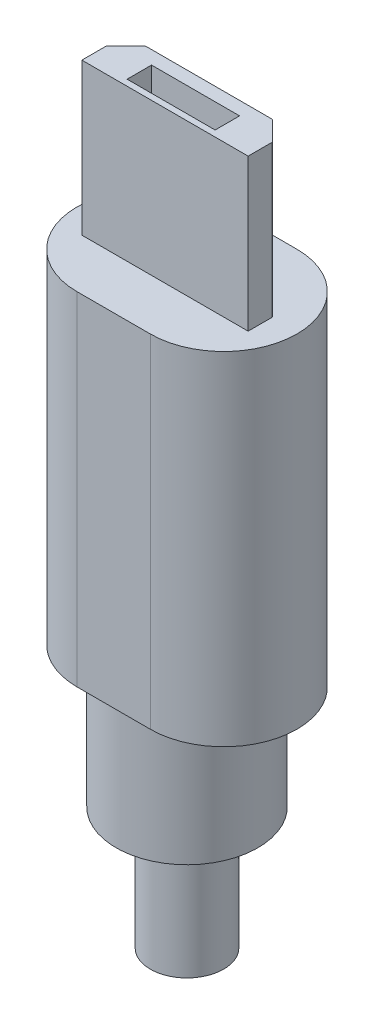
SolidWorks part; units mm, degrees
ref_plane "前视基准面" through (0, 0, 0) normal (0, 0, 1) x (1, 0, 0)
ref_plane "上视基准面" through (0, 0, 0) normal (0, 1, 0) x (1, 0, 0)
ref_plane "右视基准面" through (0, 0, 0) normal (1, 0, 0) x (0, 0, -1)
other "Configuration Table"
sketch "草图1" plane through (0, 0, 0) normal (0, 1, 0) x (1, 0, 0)
  line L0 (-1.5, 0) -> (1.5, 0) construction
  line L1 (-1.5, 3) -> (1.5, 3)
  line L2 (-1.5, -3) -> (1.5, -3)
  arc A0 (-1.5, 3) -> (-1.5, -3) centre (-1.5, 0) ccw
  arc A1 (1.5, -3) -> (1.5, 3) centre (1.5, 0) ccw
  point P3 (0, 0)
  point P9 (-4.5, 0)
  point P10 (4.5, 0)
  dimension "D1" = 3
  dimension "D2" = 9
extrude "凸台-拉伸1" add sketch "草图1" along normal blind 14
sketch "草图2" plane through (0, 0, 0) normal (0, -1, 0) x (1, 0, 0)
  circle A0 centre (0, 0) radius 2.9
  dimension "D1" = 5.8
extrude "凸台-拉伸2" add sketch "草图2" along normal blind 5
sketch "草图3" plane through (0, 14, 0) normal (0, 1, 0) x (1, 0, 0)
  line L0 (-3.4, 0.1) -> (-2.6, 0.9)
  line L1 (-3.4, 0.9) -> (3.4, 0.9) construction
  line L2 (-3.4, 0.9) -> (-3.4, -0.9) construction
  line L3 (-3.4, -0.9) -> (3.4, -0.9)
  line L4 (3.4, 0.9) -> (3.4, -0.9) construction
  line L5 (-3.4, 0.9) -> (3.4, -0.9) construction
  line L6 (-3.4, -0.9) -> (3.4, 0.9) construction
  line L7 (2.6, 0.9) -> (3.4, 0.1)
  line L8 (0, 0.9) -> (0, -0.9) construction
  line L9 (-2.6, 0.9) -> (2.6, 0.9)
  line L10 (-3.4, 0.1) -> (-3.4, -0.9)
  line L11 (3.4, 0.1) -> (3.4, -0.9)
  point P0 (0, 0)
  dimension "D1" = 6.8
  dimension "D2" = 1.8
  dimension "D3" = 0.8
  dimension "D4" = 0.8
  dimension "D5" = 0.8
  dimension "D6" = 0.8
extrude "凸台-拉伸3" add sketch "草图3" along normal blind 6.2
sketch "草图5" plane through (0, 20.2, 0) normal (0, 1, 0) x (1, 0, 0)
  line L0 (-3.4, -0.9) -> (3.4, -0.9) construction
  line L1 (1.8, -0.65) -> (-1.8, -0.65)
  line L2 (1.8, -0.65) -> (1.8, 0.35)
  line L3 (1.8, 0.35) -> (-1.8, 0.35)
  line L4 (-1.8, -0.65) -> (-1.8, 0.35)
  line L5 (1.8, -0.65) -> (-1.8, 0.35) construction
  line L6 (1.8, 0.35) -> (-1.8, -0.65) construction
  line L7 (0, 0.9) -> (0, -0.9) construction
  line L8 (2.6, 0.9) -> (-2.6, 0.9) construction
  point P0 (0, -0.15)
  dimension "D1" = 0.25
  dimension "D2" = 1
  dimension "D3" = 3.6
extrude "切除-拉伸1" cut sketch "草图5" against normal blind 4
fillet "圆角1" radius 0.1 4 edges at (3.4, 17.1, -0.1) (2.6, 17.1, -0.9) (-3.4, 17.1, -0.1) (-2.6, 17.1, -0.9)
sketch "草图6" plane through (0, -5, 0) normal (0, -1, 0) x (1, 0, 0)
  circle A0 centre (0, 0) radius 1.5
  dimension "D1" = 3
extrude "凸台-拉伸4" add sketch "草图6" along normal blind 5
sketch "草图8" plane through (0, 0, -3) normal (0, 0, -1) x (-1, 0, 0)
  line L0 (0, 11.5456) -> (0, 1.9082) construction
  line L1 (0, 11.5296) -> (-0.717, 10.8097)
  line L2 (0.635, 9.4075) -> (1.524, 9.4075)
  line L3 (0.635, 9.4075) -> (0.635, 8.5185)
  line L4 (0.635, 8.963) -> (1.524, 8.963) construction
  line L5 (0.635, 8.5185) -> (0.9547, 8.5185)
  line L6 (1.524, 9.4075) -> (1.524, 8.5185)
  line L7 (-0.127, 3.5695) -> (-0.127, 4.8449)
  line L8 (0.127, 3.5695) -> (0.127, 5.9335)
  line L9 (-0.717, 10.8097) -> (-0.127, 10.8097)
  line L10 (0.717, 10.8097) -> (0, 11.5296)
  line L11 (0, 11.5296) -> (0, 11.6076) construction
  line L12 (0.9547, 8.5185) -> (1.2043, 8.5185) construction
  line L13 (0.2185, 6.5586) -> (0.8034, 7.3428)
  line L14 (1.2043, 8.5185) -> (1.2043, 7.715)
  line L15 (1.0531, 7.2594) -> (0.1774, 6.0854)
  line L16 (-0.2102, 5.3627) -> (-1.1205, 6.1153)
  line L17 (-1.397, 6.7026) -> (-1.397, 7.9631)
  line L18 (-1.651, 12.2591) -> (-1.397, 12.2591) construction
  line L19 (-0.2192, 5.0406) -> (-1.267, 5.9069)
  line L20 (-1.651, 6.7225) -> (-1.651, 7.9631)
  line L21 (-1.524, 12.2591) -> (-1.524, 7.9619) construction
  line L22 (0.9547, 8.5185) -> (0.9547, 7.7984)
  line L23 (0.127, 6.7225) -> (-0.127, 6.7225) construction
  line L24 (0, 6.7225) -> (0, 7.1521) construction
  line L25 (0.127, 10.8097) -> (0.717, 10.8097)
  line L26 (1.2043, 8.5185) -> (1.524, 8.5185)
  line L27 (-0.127, 5.4019) -> (-0.127, 10.8097)
  line L28 (0.127, 6.589) -> (0.127, 10.8097)
  line L29 (0, 11.9082) -> (0, 11.5296) construction
  line L34 (0, 0) -> (0, 14) construction
  line L35 (-1.5, 14) -> (1.5, 14) construction
  arc A0 (-0.127, 3.5695) -> (0.127, 3.5695) centre (0, 2.9474) ccw
  arc A1 (-1.397, 7.9631) -> (-1.651, 7.9631) centre (-1.524, 8.455) ccw
  arc A2 (1.2043, 7.715) -> (1.0531, 7.2594) centre (0.4423, 7.715) cw
  arc A3 (0.9547, 7.7984) -> (0.8034, 7.3428) centre (0.1927, 7.7984) cw
  arc A4 (-1.397, 6.7026) -> (-1.1205, 6.1153) centre (-0.635, 6.7026) ccw
  arc A5 (-1.651, 6.7225) -> (-1.267, 5.9069) centre (-0.5927, 6.7225) ccw
  arc A6 (-0.127, 5.4019) -> (-0.2102, 5.3627) centre (-0.1778, 5.4019) cw
  arc A7 (0.127, 6.589) -> (0.2185, 6.5586) centre (0.1778, 6.589) ccw
  arc A8 (0.1774, 6.0854) -> (0.127, 5.9335) centre (0.381, 5.9335) ccw
  arc A9 (-0.127, 4.8449) -> (-0.2192, 5.0406) centre (-0.381, 4.8449) ccw
  dimension "D1" = 1.27
  dimension "D2" = 1.016
  dimension "D9" = 0.762
  dimension "D12" = 0.762
  dimension "D14" = 0.0508
  dimension "D15" = 0.254
  dimension "D25" = 1.0583
  dimension "D3" = 0.889
  dimension "D4" = 1.016
  dimension "D5" = 0.508
  dimension "D6" = 1.397
  dimension "D7" = 0.508
  dimension "D8" = 0.254
  dimension "D10" = 0.254
  dimension "D11" = 50.42
  dimension "D13" = 0.254
  dimension "D19" = 0.2497
  dimension "D21" = 0.3786
  dimension "D22" = 5.5076
  dimension "D23" = 1.8975
  dimension "D24" = 7.8624
  dimension "D26" = 2.9862
  dimension "D27" = 3.6416
  dimension "D28" = 0.25
  dimension "D29" = 1.126
extrude "切除-拉伸2" cut sketch "草图8" against normal blind 0.1
